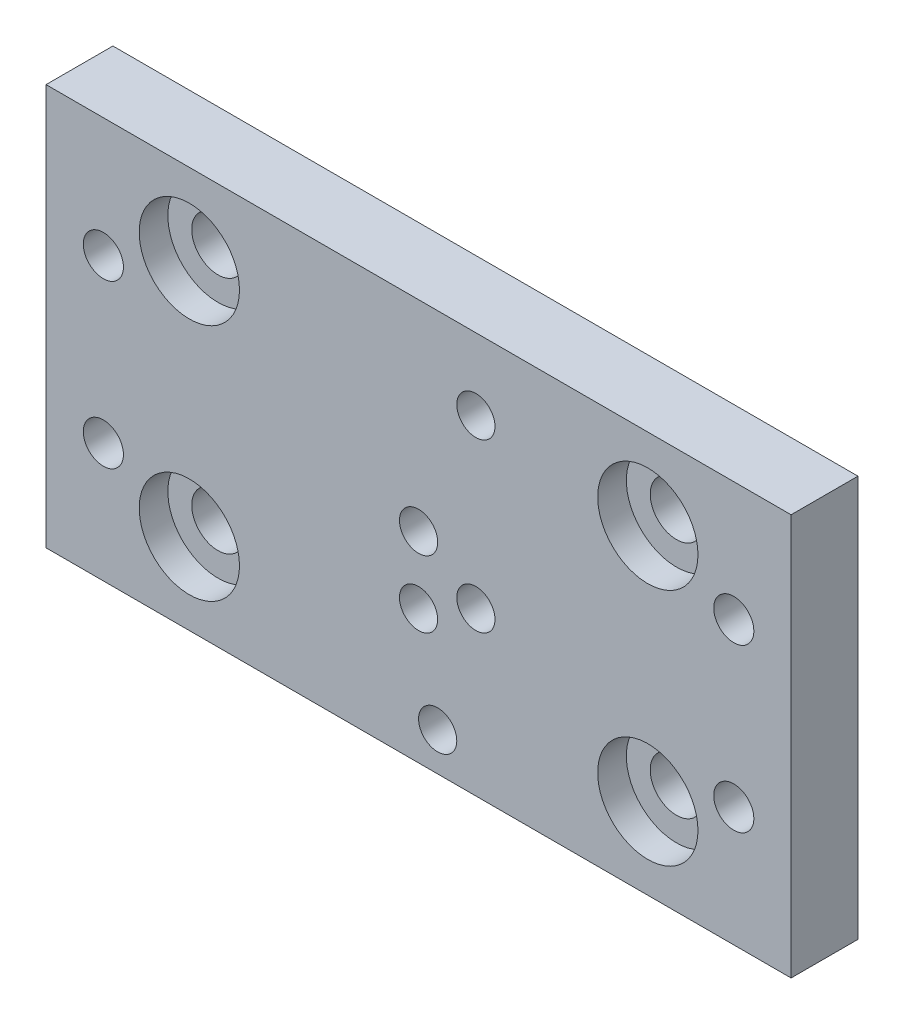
SolidWorks part; units mm, degrees
ref_plane "Face" through (0, 0, 0) normal (0, 0, 1) x (1, 0, 0)
ref_plane "Dessus" through (0, 0, 0) normal (0, 1, 0) x (1, 0, 0)
ref_plane "Droite" through (0, 0, 0) normal (1, 0, 0) x (0, 0, -1)
sketch "Esquisse1" plane through (0, 0, 0) normal (0, 0, 1) x (1, 0, 0)
  line L0 (0, 20.3729) -> (0, -14.5521) construction
  line L1 (-39, 21) -> (39, 21)
  line L2 (-39, 21) -> (-39, -21)
  line L3 (-39, -21) -> (39, -21)
  line L4 (39, 21) -> (39, -21)
  line L5 (-24.0594, 0) -> (31.4325, 0) construction
  dimension "D1" = 78
  dimension "D2" = 42
extrude "Extrusion1" add sketch "Esquisse1" along normal blind 7
hole_wizard "Trou taraudé M5x0.81" positions "Esquisse3" profile "Esquisse2" tap size "M5x0.8" standard "ISO"
sketch "Esquisse3" plane through (0, 0, 7) normal (0, 0, 1) x (1, 0, 0)
  line L0 (0, 5.9583) -> (0, -6.3194) construction
  line L1 (-5.1759, 0) -> (4.8148, 0) construction
  point P0 (33, -8.5)
  point P1 (-33, -8.5)
  point P2 (-33, 8.5)
  point P3 (33, 8.5)
  dimension "D1" = 66
  dimension "D2" = 17
sketch "Esquisse2" plane through (33, -8.5, 7) normal (1, 0, 0) x (0, -1, 0)
  line L0 (0, 0) -> (0, 7)
  line L1 (0, 7) -> (2.1, 7)
  line L2 (2.1, 7) -> (2.1, 0)
  line L5 (2.1, 0) -> (0, 0)
  line L11 (0, -6.35) -> (0, 107.95) construction
  dimension "Diamètre du trou pour taraudage jusqu'au prochain" = 4.2
  dimension "Profondeur du trou pour taraudage jusqu'au prochain" = 7
hole_wizard "Chambrage pour vis à tête cylindrique à 6 pans creux (vis CHC) M51" positions "Esquisse5" profile "Esquisse4" counterbore size "M5" standard "ISO"
sketch "Esquisse5" plane through (0, 0, 7) normal (0, 0, 1) x (1, 0, 0)
  line L0 (-4.2053, 0) -> (5.2922, 0) construction
  line L1 (0, 5.4546) -> (0, -3.1247) construction
  point P0 (-24, 12.5)
  point P1 (24, 12.5)
  point P2 (24, -12.5)
  point P3 (-24, -12.5)
  dimension "D1" = 48
  dimension "D2" = 25
sketch "Esquisse4" plane through (-24, 12.5, 7) normal (1, 0, 0) x (0, -1, 0)
  line L0 (0, 0) -> (0, 10.6524)
  line L1 (0, 10.6524) -> (2.75, 9)
  line L2 (2.75, 9) -> (2.75, 3)
  line L3 (2.75, 3) -> (5.25, 3)
  line L4 (5.25, 3) -> (5.25, 0)
  line L5 (5.25, 0) -> (0, 0)
  line L10 (0, 10.6524) -> (-2.75, 9) construction
  line L11 (0, -6.35) -> (0, 107.95) construction
  dimension "Diamètre du perçage" = 5.5
  dimension "Profondeur du perçage" = 9
  dimension "Diamètre du chambrage" = 10.5
  dimension "Profondeur du chambrage" = 3
  dimension "Angle de pointe" = 118
sketch "Esquisse6" plane through (0, 0, 7) normal (0, 0, 1) x (1, 0, 0)
  circle A0 centre (0, 0) radius 1.1
  circle A2 centre (6, 13.5) radius 1.1
  circle A3 centre (0, -7) radius 1.1
  circle A4 centre (6, -4) radius 1.1
  circle A5 centre (2, -17) radius 1.1
  dimension "D1" = 2.2
  dimension "D2" = 7
  dimension "D3" = 6
  dimension "D4" = 2
  dimension "D5" = 17
  dimension "D6" = 13.5
  dimension "D7" = 2.2
  dimension "D8" = 4
extrude "Enlèv. mat.-Extru.1" cut sketch "Esquisse6" against normal through all
sketch "Esquisse7" plane through (0, 0, 7) normal (0, 0, 1) x (1, 0, 0)
  circle A1 centre (6, 13.5) radius 2
  circle A2 centre (0, 0) radius 2
  circle A3 centre (6, -4) radius 2
  circle A4 centre (0, -7) radius 2
  circle A5 centre (2, -17) radius 2
  dimension "D1" = 4
extrude "Enlèv. mat.-Extru.2" cut sketch "Esquisse7" against normal blind 3
